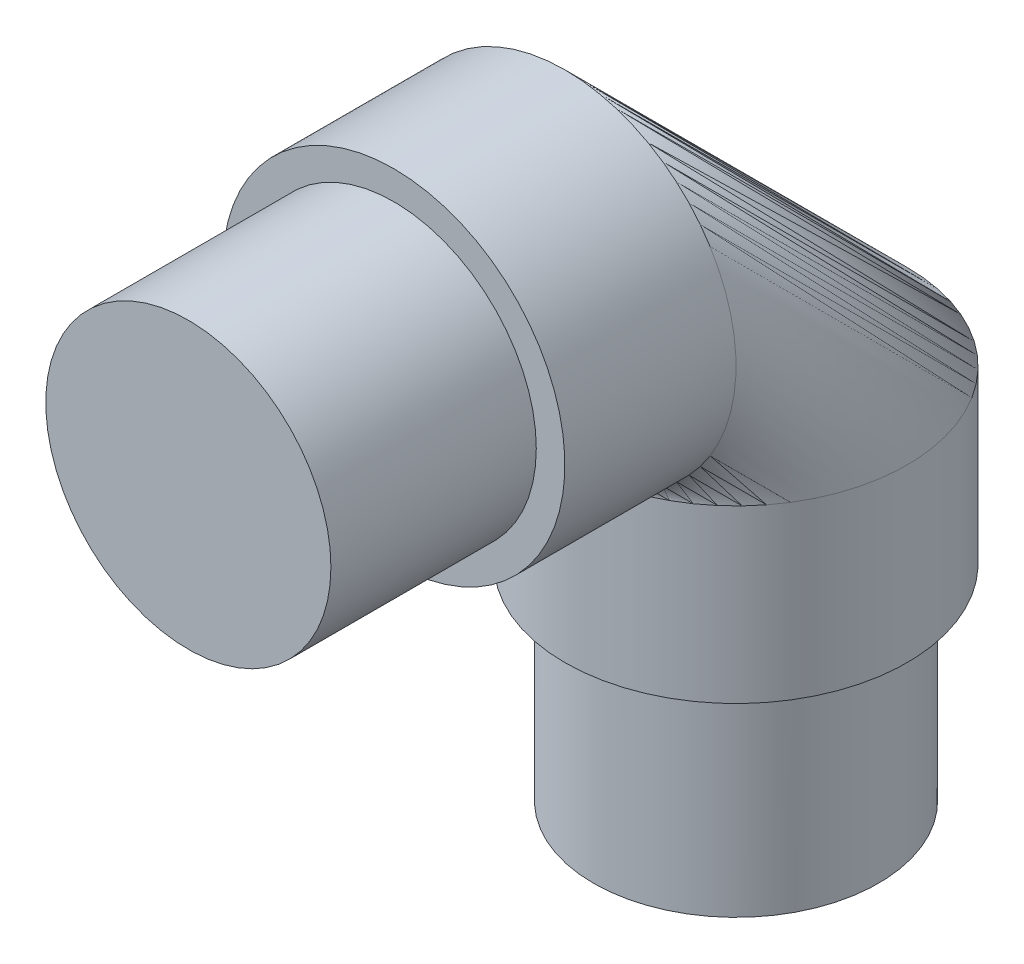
SolidWorks part; units mm, degrees
ref_plane "前视基准面" through (0, 0, 0) normal (0, 0, 1) x (1, 0, 0)
ref_plane "上视基准面" through (0, 0, 0) normal (0, 1, 0) x (1, 0, 0)
ref_plane "右视基准面" through (0, 0, 0) normal (1, 0, 0) x (0, 0, -1)
sketch "草图1" plane through (0, 0, 0) normal (0, 0, 1) x (1, 0, 0)
  circle A0 centre (0, 0) radius 8.33
extrude "凸台-拉伸1" add sketch "草图1" along normal blind 12
sketch "草图2" plane through (0, 0, 0) normal (1, 0, 0) x (0, 0, -1)
  line L0 (0, 0) -> (10, 0)
  line L1 (20, -10) -> (20, -20)
  arc A0 (10, 0) -> (20, -10) centre (10, -10) cw
  dimension "D1" = 10
sweep "扫描1" add path "草图2" parameters "D3"=20
sketch "草图15" plane through (0, -20, 0) normal (0, -1, 0) x (1, 0, 0)
  circle A0 centre (0, -20) radius 8.33
extrude "凸台-拉伸2" add sketch "草图15" along normal blind 12
